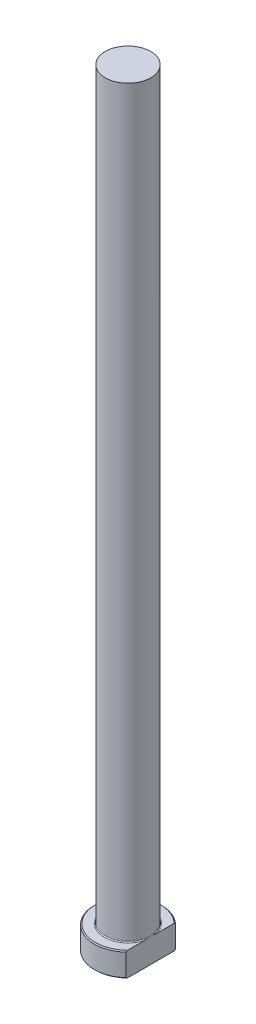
SolidWorks part; units mm, degrees
ref_plane "Front Plane" through (0, 0, 0) normal (0, 0, 1) x (1, 0, 0)
ref_plane "Top Plane" through (0, 0, 0) normal (0, 1, 0) x (1, 0, 0)
ref_plane "Right Plane" through (0, 0, 0) normal (1, 0, 0) x (0, 0, -1)
sketch "Sketch1" plane through (0, 0, 0) normal (0, 0, 1) x (1, 0, 0)
  line L0 (0, 259.9588) -> (0, -15.1925) construction
  line L1 (0, 0) -> (-7, 0)
  line L2 (-7, 0) -> (-7, 5)
  line L3 (-7, 5) -> (-4.75, 5)
  line L4 (-4.75, 5) -> (-4.75, 160)
  line L5 (-4.75, 160) -> (0, 160)
  line L6 (0, 160) -> (0, 0)
  dimension "L" = 160
  dimension "H" = 14
  dimension "T" = 5
  dimension "D" = 9.5
revolve "Revolve1" add sketch "Sketch1" angle 360 about L0
chamfer "Chamfer1" distance 0.2 angle 45 2 edges at (0, 5, 7) (0, 0, 7)
fillet "Fillet1" radius 0.2 1 edges at (0, 5, 4.75)
sketch "Sketch2" plane through (0, 0, 0) normal (0, 1, 0) x (1, 0, 0)
  line L0 (4.75, 5.1417) -> (4.75, -5.1417)
  circle A0 centre (0, 0) radius 7 construction
  arc A1 (4.75, -5.1417) -> (4.75, 5.1417) centre (0, 0) ccw
  circle A2 centre (0, 0) radius 4.75 construction
extrude "KEY" cut sketch "Sketch2" along normal through all
